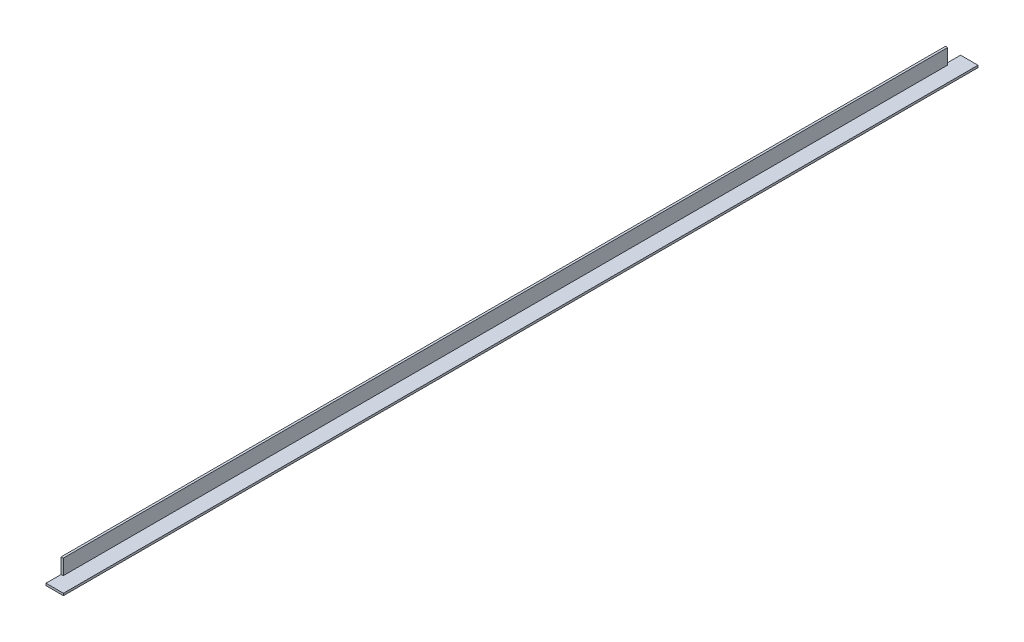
SolidWorks part; units mm, degrees
ref_plane "Front Plane" through (0, 0, 0) normal (0, 0, 1) x (1, 0, 0)
ref_plane "Top Plane" through (0, 0, 0) normal (0, 1, 0) x (1, 0, 0)
ref_plane "Right Plane" through (0, 0, 0) normal (1, 0, 0) x (0, 0, -1)
sketch "Sketch1" plane through (0, 0, 0) normal (0, 0, 1) x (1, 0, 0)
  line L0 (0, 0) -> (0, 38.1)
  line L1 (0, 0) -> (38.1, 0)
  line L2 (38.1, 0) -> (38.1, 4.7498)
  line L3 (38.1, 4.7498) -> (4.7498, 4.7498)
  line L4 (4.7498, 4.7498) -> (4.7498, 38.1)
  line L5 (4.7498, 38.1) -> (0, 38.1)
  dimension "D1" = 38.1
  dimension "D2" = 38.1
  dimension "D3" = 4.7498
  dimension "D4" = 4.7498
extrude "Boss-Extrude1" add sketch "Sketch1" along normal blind 1934.21
sketch "Sketch4" plane through (0, 0, 0) normal (0, 0, -1) x (-1, 0, 0)
  line L0 (-38.1, 4.7498) -> (-38.1, 0)
  line L1 (-38.1, 0) -> (0, 0)
  line L2 (0, 0) -> (0, 4.7498)
  line L3 (0, 38.1) -> (0, 0) construction
  line L4 (0, 4.7498) -> (-38.1, 4.7498)
extrude "1.3 ext." add sketch "Sketch4" along normal blind 33.02
sketch "Sketch5" plane through (0, 0, 1934.21) normal (0, 0, 1) x (1, 0, 0)
  line L0 (0, 0) -> (38.1, 0)
  line L1 (38.1, 0) -> (38.1, 4.7498)
  line L2 (38.1, 4.7498) -> (0, 4.7498)
  line L3 (0, 38.1) -> (0, 0) construction
  line L4 (0, 4.7498) -> (0, 0)
extrude "Boss-Extrude5" add sketch "Sketch5" along normal blind 33.02
